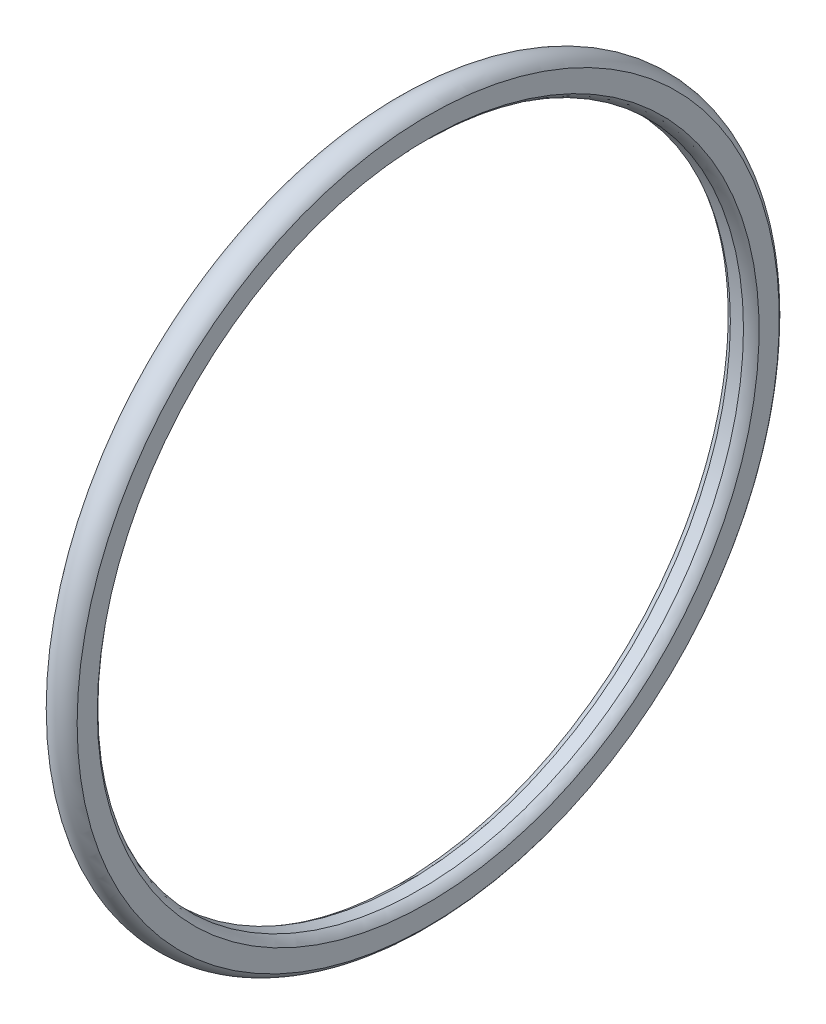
SolidWorks part; units mm, degrees
ref_plane "Plan1" through (0, 0, 0) normal (0, 0, 1) x (1, 0, 0)
ref_plane "Plan2" through (0, 0, 0) normal (0, 1, 0) x (1, 0, 0)
ref_plane "Plan3" through (0, 0, 0) normal (1, 0, 0) x (0, 0, -1)
sketch "Esquisse1" plane through (0, 0, 0) normal (0, 0, 1) x (1, 0, 0)
  line L0 (-50, 0) -> (40, 0) construction
  line L1 (-7.5, 57.6583) -> (-7.5, 54.3417)
  line L2 (-10, 53.2) -> (-8.923, 53.2)
  line L3 (-10, 53.2) -> (-11.077, 53.2)
  arc A0 (-7.5, 57.6583) -> (-11.077, 53.2) centre (-10, 56) ccw
  arc A1 (-8.923, 53.2) -> (-7.5, 54.3417) centre (-10, 56) ccw
  dimension "D1" = 6
  dimension "D2" = 56
  dimension "D3" = 2.5
revolve "Base-Révolution" add sketch "Esquisse1" angle 360 about L0
